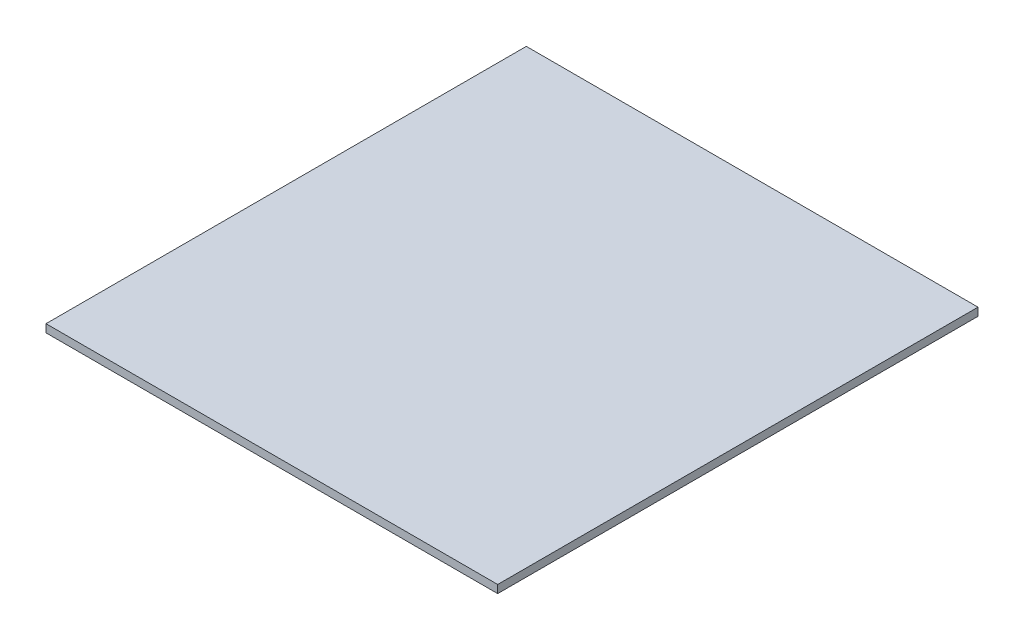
SolidWorks part; units mm, degrees
ref_plane "Front" through (0, 0, 0) normal (0, 0, 1) x (1, 0, 0)
ref_plane "Top" through (0, 0, 0) normal (0, 1, 0) x (1, 0, 0)
ref_plane "Right" through (0, 0, 0) normal (1, 0, 0) x (0, 0, -1)
sketch "Sketch1" plane through (0, 0, 0) normal (0, 1, 0) x (1, 0, 0)
  line L1 (0, 0) -> (90.17, 0)
  line L2 (0, 0) -> (0, 95.885)
  line L3 (0, 95.885) -> (90.17, 95.885)
  line L4 (90.17, 0) -> (90.17, 95.885)
  dimension "D1" = 90.17
  dimension "D2" = 95.885
extrude "Extrude1" add sketch "Sketch1" along normal blind 1.5875
